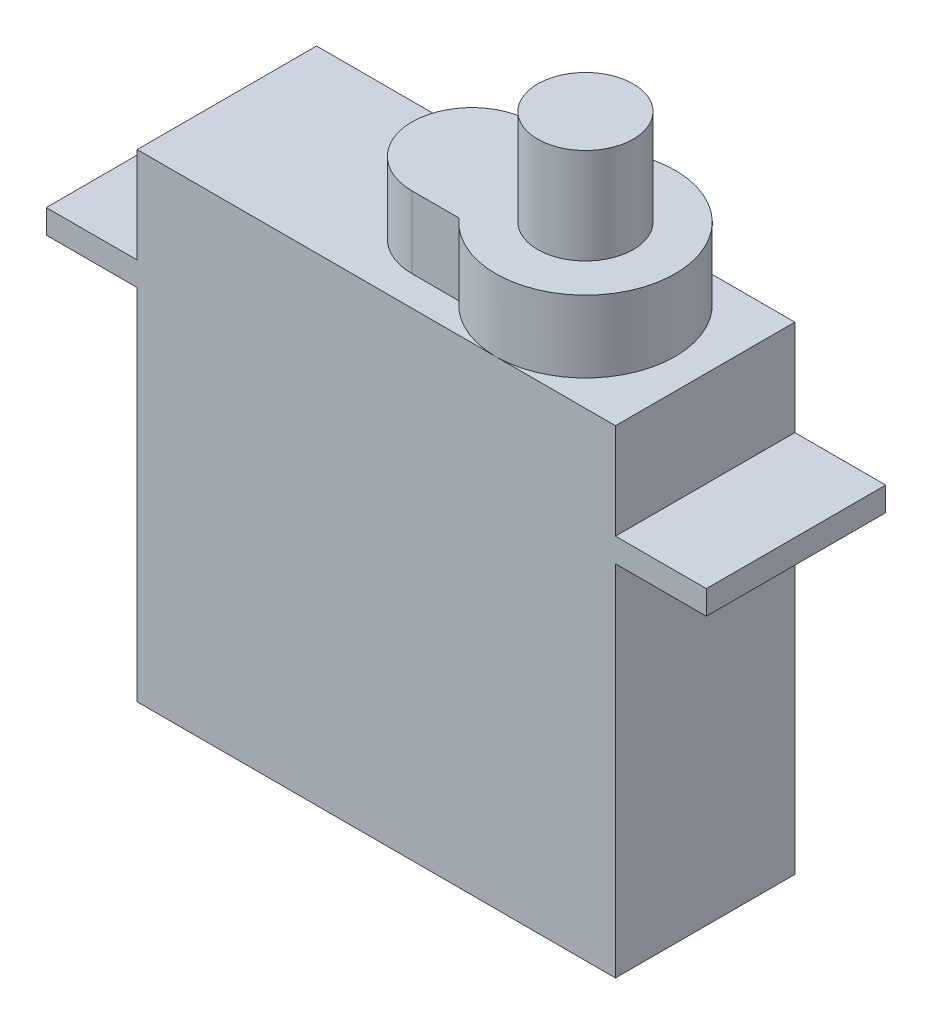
SolidWorks part; units mm, degrees
ref_plane "Plan de face" through (0, 0, 0) normal (0, 0, 1) x (1, 0, 0)
ref_plane "Plan de dessus" through (0, 0, 0) normal (0, 1, 0) x (1, 0, 0)
ref_plane "Plan de droite" through (0, 0, 0) normal (1, 0, 0) x (0, 0, -1)
sketch "Esquisse1" plane through (0, 0, 0) normal (0, 0, 1) x (1, 0, 0)
  line L0 (10, 0) -> (10, 26.0052) construction
  line L1 (0, 0) -> (20, 0)
  line L2 (0, 0) -> (0, 15)
  line L3 (0, 20) -> (7.745, 20)
  line L4 (20, 0) -> (20, 15)
  line L5 (0, 16) -> (-3.8, 16)
  line L7 (0, 15) -> (-3.8, 15)
  line L8 (-3.8, 16) -> (-3.8, 15)
  line L9 (20, 16) -> (23.8, 16)
  line L11 (20, 15) -> (23.8, 15)
  line L12 (23.8, 16) -> (23.8, 15)
  line L13 (20, 16) -> (20, 20)
  line L14 (0, 16) -> (0, 20)
  line L15 (18.745, 20) -> (20, 20)
  line L16 (7.745, 23) -> (18.745, 23)
  line L17 (7.745, 23) -> (7.745, 20)
  line L19 (18.745, 23) -> (18.745, 20)
  dimension "D1" = 20
  dimension "D2" = 20
  dimension "D3" = 15
  dimension "D4" = 15
  dimension "D5" = 27.6
  dimension "D6" = 1
  dimension "D7" = 1
  dimension "D8" = 3
  dimension "D9" = 11
extrude "Boss.-Extru.1" add sketch "Esquisse1" along normal blind 7.5
sketch "Esquisse2" plane through (0, 23, 0) normal (0, 1, 0) x (1, 0, 0)
  line L0 (18.745, 0) -> (7.745, 0) construction
  line L1 (18.745, -7.5) -> (7.745, -7.5) construction
  line L2 (18.745, -7.5) -> (18.745, 0) construction
  line L3 (7.745, -7.5) -> (7.745, 0) construction
  line L4 (10.245, -1.25) -> (12.1999, -1.25)
  line L5 (10.245, -6.25) -> (12.1999, -6.25)
  arc A0 (12.1999, -6.25) -> (12.1999, -1.25) centre (14.995, -3.75) ccw
  arc A1 (10.245, -1.25) -> (10.245, -6.25) centre (10.245, -3.75) ccw
  dimension "D1" = 5
extrude "Enlèv. mat.-Extru.1" cut sketch "Esquisse2" against normal up to surface (3 mm away) flip side to cut
sketch "Esquisse3" plane through (0, 23, 0) normal (0, 1, 0) x (1, 0, 0)
  circle A0 centre (14.995, -3.75) radius 2
  dimension "D1" = 4
extrude "Boss.-Extru.2" add sketch "Esquisse3" along normal blind 4
